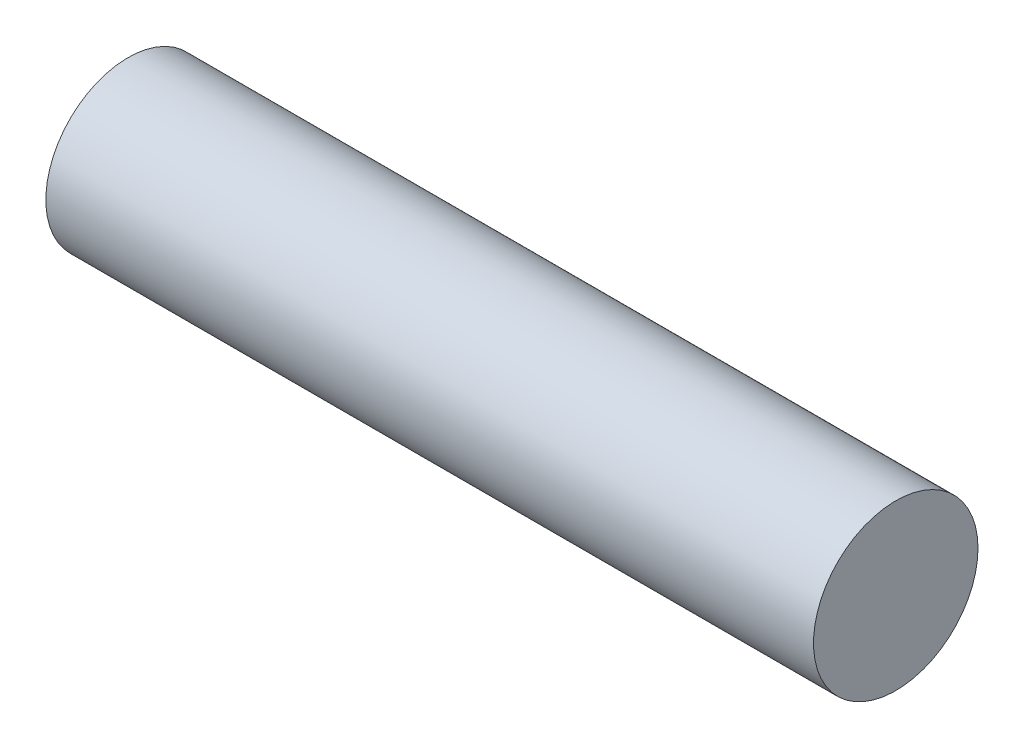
SolidWorks part; units mm, degrees
ref_plane "Front Plane" through (0, 0, 0) normal (0, 0, 1) x (1, 0, 0)
ref_plane "Top Plane" through (0, 0, 0) normal (0, 1, 0) x (1, 0, 0)
ref_plane "Right Plane" through (0, 0, 0) normal (1, 0, 0) x (0, 0, -1)
sketch "Sketch1" plane through (0, 0, 0) normal (1, 0, 0) x (0, 0, -1)
  circle A0 centre (0, 0) radius 15
  dimension "D1" = 30
extrude "Boss-Extrude1" add sketch "Sketch1" along normal mid plane 140
